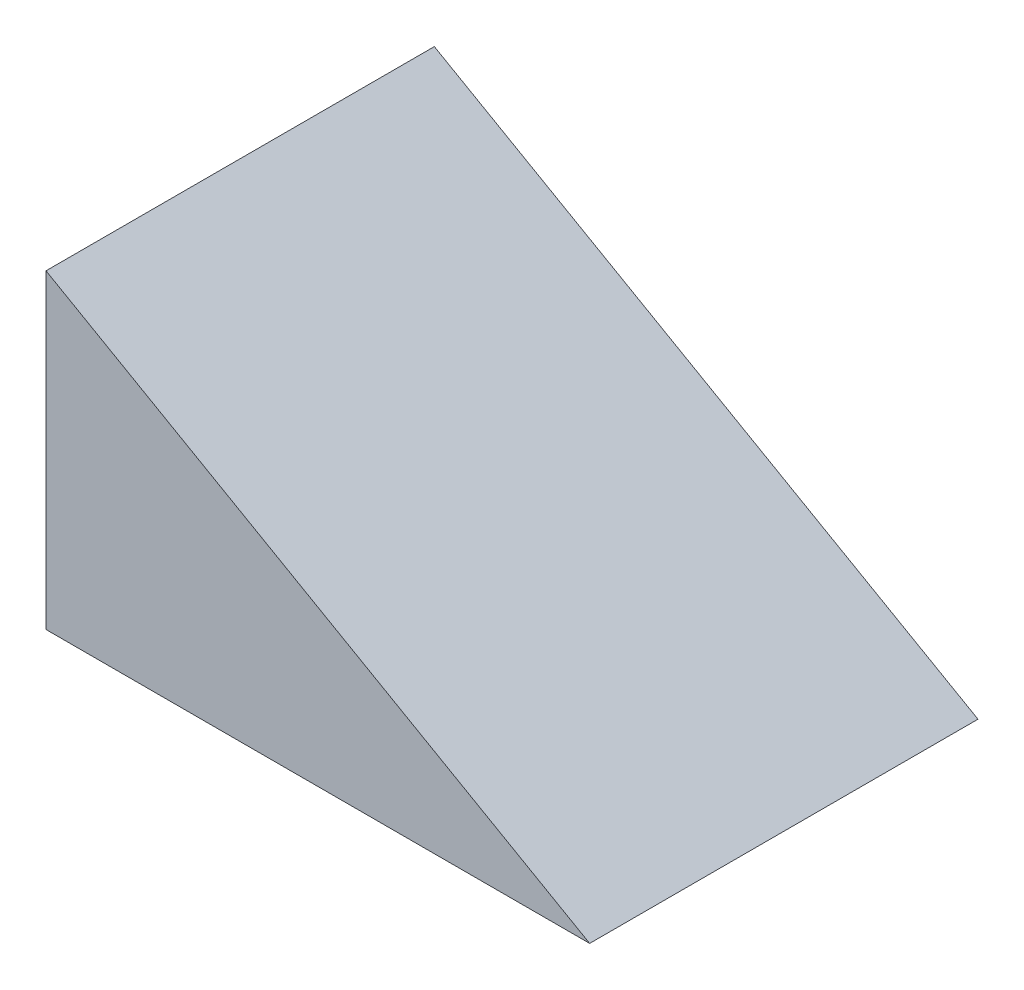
SolidWorks part; units mm, degrees
ref_plane "Front Plane" through (0, 0, 0) normal (0, 0, 1) x (1, 0, 0)
ref_plane "Top Plane" through (0, 0, 0) normal (0, 1, 0) x (1, 0, 0)
ref_plane "Right Plane" through (0, 0, 0) normal (1, 0, 0) x (0, 0, -1)
sketch "Sketch1" plane through (0, 0, 0) normal (0, 0, 1) x (1, 0, 0)
  line L0 (0, 0) -> (70, 0)
  line L1 (0, 0) -> (0, 40)
  line L2 (0, 40) -> (70, 0)
  dimension "D1" = 40
  dimension "D2" = 70
extrude "Boss-Extrude1" add sketch "Sketch1" along normal blind 50
